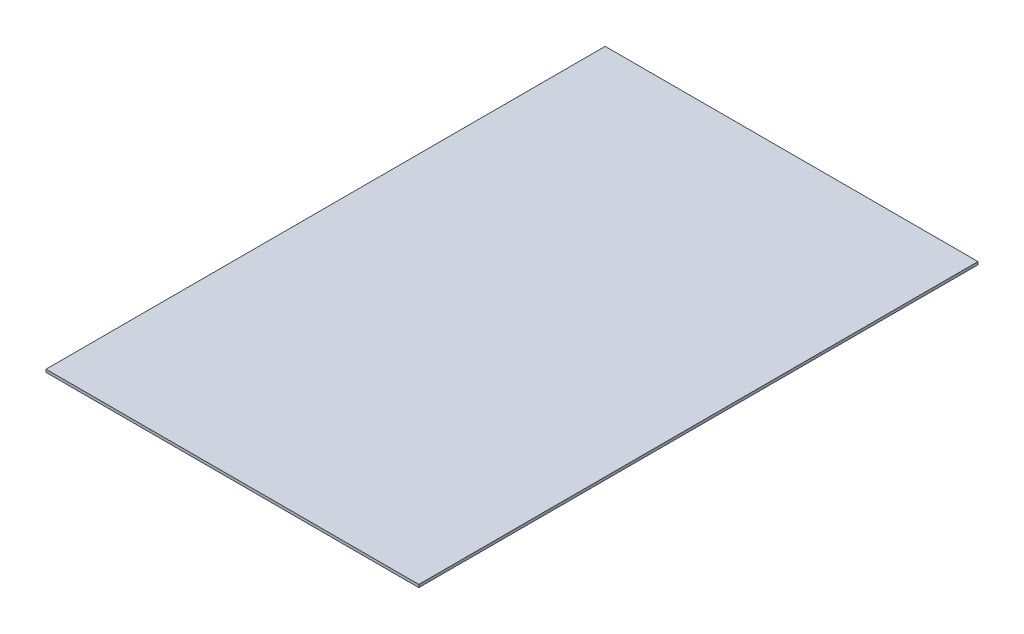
SolidWorks part; units mm, degrees
ref_plane "Face" through (0, 0, 0) normal (0, 0, 1) x (1, 0, 0)
ref_plane "Dessus" through (0, 0, 0) normal (0, 1, 0) x (1, 0, 0)
ref_plane "Droite" through (0, 0, 0) normal (1, 0, 0) x (0, 0, -1)
sketch "Esquisse1" plane through (0, 0, 0) normal (0, 1, 0) x (1, 0, 0)
  line L1 (0, 0) -> (400, 0)
  line L2 (0, 0) -> (0, 600)
  line L3 (0, 600) -> (400, 600)
  line L4 (400, 0) -> (400, 600)
  dimension "D1" = 400
  dimension "D2" = 600
extrude "Extrusion1" add sketch "Esquisse1" along normal blind 3
